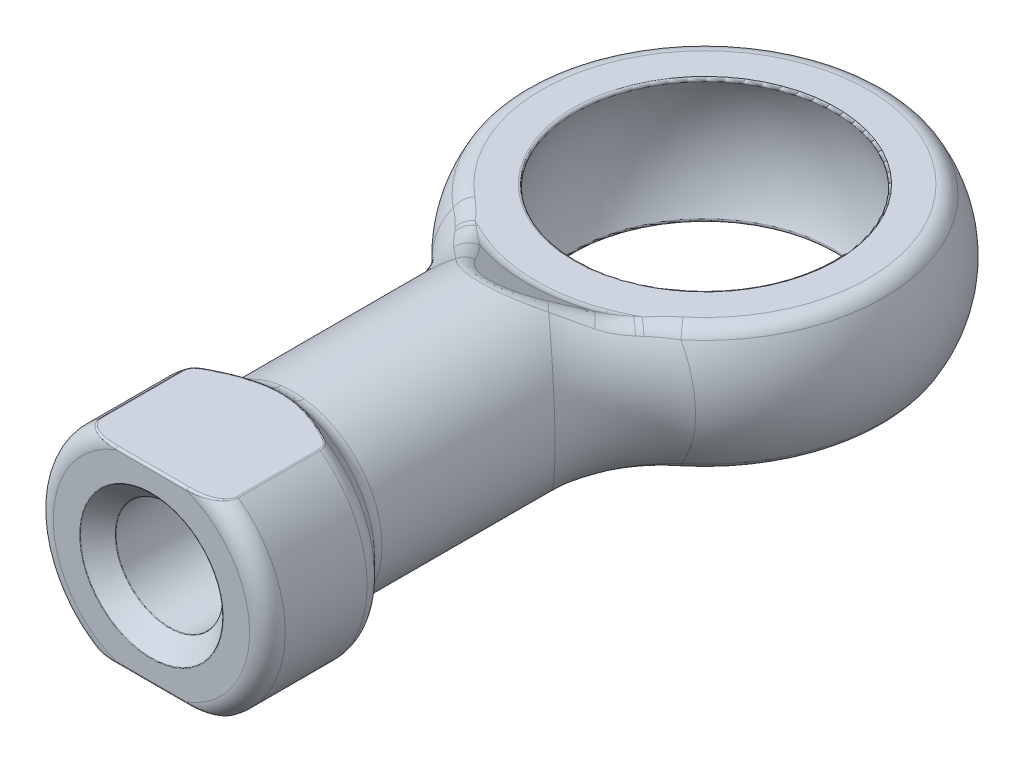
SolidWorks part; units mm, degrees
ref_plane "Front Plane" through (0, 0, 0) normal (0, 0, 1) x (1, 0, 0)
ref_plane "Top Plane" through (0, 0, 0) normal (0, 1, 0) x (1, 0, 0)
ref_plane "Right Plane" through (0, 0, 0) normal (1, 0, 0) x (0, 0, -1)
sketch "Sketch1" plane through (0, 0, 0) normal (0, 0, 1) x (1, 0, 0)
  line L0 (16, 0) -> (0, 0) construction
  line L1 (0, 0) -> (0, 21.4008) construction
  line L2 (14.3875, 7) -> (19.3875, 7)
  line L3 (14.3875, -7) -> (19.3875, -7)
  arc A0 (16, 0) -> (14.3875, 7) centre (0, 0) ccw
  arc A1 (16, 0) -> (14.3875, -7) centre (0, 0) cw
  arc A2 (19.3875, 7) -> (19.3875, -7) centre (9.6407, 0) cw
  dimension "D3" = 16
  dimension "D4" = 12
  dimension "D1" = 14
  dimension "D2" = 5
revolve "Revolve1" add sketch "Sketch1" angle 360 about L1
ref_plane "Plane1" through (0, 0, 17) normal (0, 0, 1) x (1, 0, 0)
sketch "Sketch3" plane through (0, 0, 17) normal (0, 0, 1) x (1, 0, 0)
  circle A0 centre (0, 0) radius 10
  dimension "D1" = 20
extrude "Boss-Extrude1" add sketch "Sketch3" along normal blind 45
sketch "Sketch5" plane through (0, 7, 0) normal (0, 1, 0) x (1, 0, 0)
  circle A0 centre (0, 0) radius 19.3875
extrude "Cut-Extrude1" cut sketch "Sketch5" along normal through all draft 60
mirror "Mirror1" about plane through (0, 0, 0) normal (0, 1, 0) of "Cut-Extrude1"
fillet "Fillet1" radius 15 2 edges at (9.9325, 1.1596, 19.1634) (-9.9325, -1.1596, 19.1634)
sketch "Sketch7" plane through (0, 0, 0) normal (0, 1, 0) x (1, 0, 0)
  line L0 (-10, -62) -> (10, -62) construction
  line L1 (-10, -62) -> (10, -62) construction
  line L2 (-10, -62) -> (-10, -47)
  line L3 (-10, -47) -> (-13, -50)
  line L4 (-13, -50) -> (-13, -62)
  line L5 (-13, -62) -> (-10, -62)
  line L6 (0, -62) -> (0, -48.8375) construction
  dimension "D1" = 45
  dimension "D2" = 12
  dimension "D3" = 3
revolve "Revolve2" add sketch "Sketch7" angle 360 about L6
sketch "Sketch8" plane through (0, 0, 62) normal (0, 0, 1) x (1, 0, 0)
  line L0 (0, 10) -> (0, 10.5) construction
  line L1 (-15, -10.5) -> (15, -10.5)
  line L2 (-15, -10.5) -> (-15, 10.5)
  line L3 (-15, 10.5) -> (15, 10.5)
  line L4 (15, -10.5) -> (15, 10.5)
  line L5 (-15, -10.5) -> (15, 10.5) construction
  line L6 (-15, 10.5) -> (15, -10.5) construction
  circle A0 centre (0, 0) radius 10 construction
  circle A1 centre (0, 0) radius 10 construction
  dimension "D1" = 0.5
  dimension "D2" = 30
extrude "Cut-Extrude3" cut sketch "Sketch8" against normal blind 20 flip side to cut
sketch "Sketch9" plane through (0, 0, 62) normal (0, 0, 1) x (1, 0, 0)
  circle A0 centre (0, 0) radius 6
  dimension "D1" = 12
extrude "Cut-Extrude4" cut sketch "Sketch9" against normal blind 30
chamfer "Chamfer1" distance 2 angle 45 1 edges at (6, 0, 62)
fillet "Fillet2" radius 2 2 edges at (0, -7, 19.3875) (0, 7, 19.3875)
fillet "Fillet3" radius 2 17 edges at (0, -7, -19.3875) (6.0854, -8.2033, 20.5913) (-0.8086, 9.9673, 24.5136) (0, 7, -19.3875) (-13, 0, 62) (-13, 0, 50) (13, 0, 50) (13, 0, 62) (10, 0, 47) (-0.8086, -9.9673, 24.5136)
fillet "Fillet4" radius 0.25 22 edges at (7.5289, -10.5, 50.2695) (-7.3272, -10.5, 49.9645) (-7.6649, -10.5, 55.4142) (-7.1246, -10.5, 61.0712) (0, -10.5, 62) (7.3272, -10.5, 60.8639) (7.6649, -10.5, 55.4142) (-7.3272, 10.5, 60.8639) (-7.6649, 10.5, 55.4142) (-7.5289, 10.5, 50.2695) (7.3272, 10.5, 49.9645) (7.6649, 10.5, 55.4142) (7.1246, 10.5, 61.0712) (0, 10.5, 62) (0, 7, -14.3875) (0, -7, -14.3875)
fillet "Fillet5" radius 0.1 2 edges at (6, 0, 60) (8, 0, 62)
